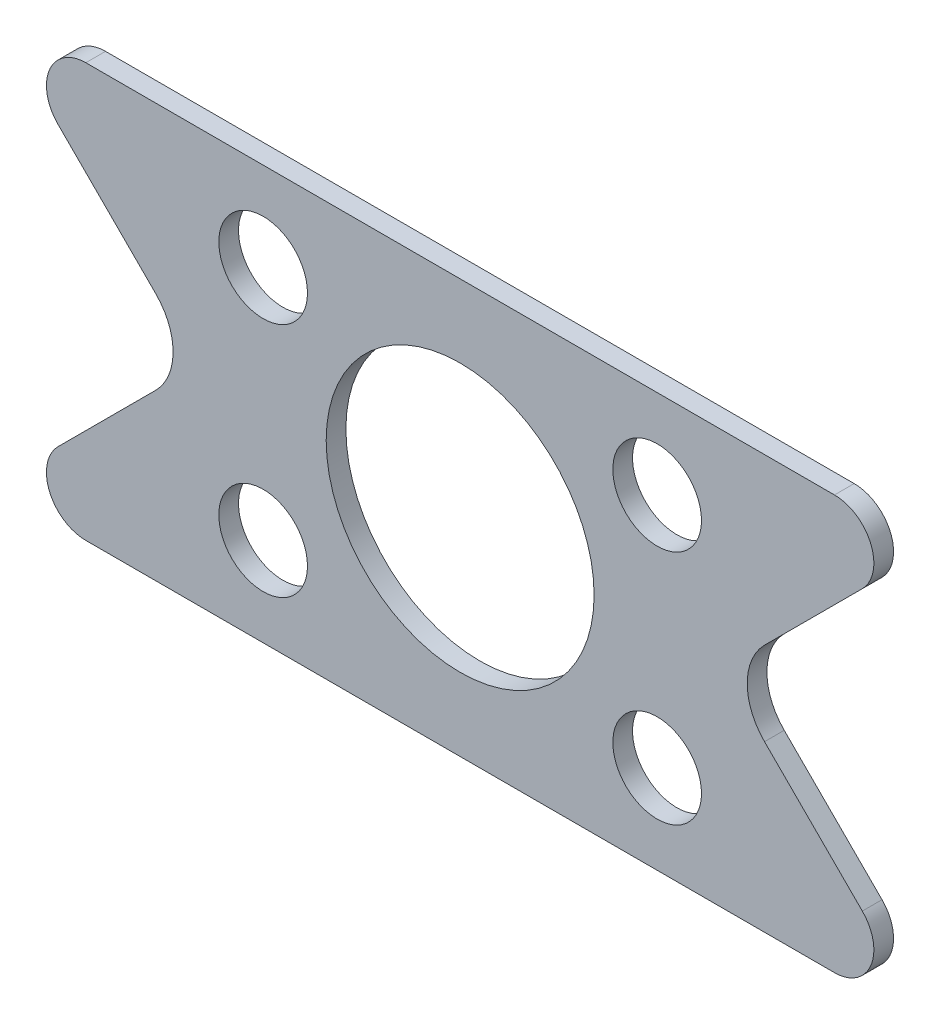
SolidWorks part; units mm, degrees
ref_plane "Plan de face" through (0, 0, 0) normal (0, 0, 1) x (1, 0, 0)
ref_plane "Plan de dessus" through (0, 0, 0) normal (0, 1, 0) x (1, 0, 0)
ref_plane "Plan de droite" through (0, 0, 0) normal (1, 0, 0) x (0, 0, -1)
sketch "Esquisse1" plane through (0, 0, 0) normal (0, 0, 1) x (1, 0, 0)
  line L1 (-210, -105) -> (210, -105)
  line L2 (-210, -105) -> (-210, 105)
  line L3 (-210, 105) -> (210, 105)
  line L4 (210, -105) -> (210, 105)
  circle A0 centre (0, 0) radius 68
  circle A1 centre (100, 60) radius 22.5
  circle A2 centre (100, -60) radius 22.5
  circle A3 centre (-100, -60) radius 22.5
  circle A4 centre (-100, 60) radius 22.5
  point P4 (0, 105)
  point P6 (-210, 0)
  dimension "D3" = 136
  dimension "D5" = 200
  dimension "D8" = 45
  dimension "D1" = 420
  dimension "D2" = 210
  dimension "D4" = 100
  dimension "D6" = 60
  dimension "D7" = 120
extrude "Extrusion1" add sketch "Esquisse1" along normal blind 10
sketch "Esquisse2" plane through (0, 0, 10) normal (0, 0, 1) x (1, 0, 0)
  line L0 (210, -105) -> (210, 105) construction
  line L1 (210, 105) -> (-210, 105) construction
  line L2 (-210, -105) -> (210, -105) construction
  line L3 (0, 0) -> (224.6287, 0) construction
  line L4 (204.1421, 70.8579) -> (154.4975, 21.2132)
  line L5 (154.4975, -21.2132) -> (204.1421, -70.8579)
  line L6 (190, 105) -> (228.981, 105)
  line L7 (190, -105) -> (228.981, -105)
  line L8 (228.981, -105) -> (228.981, 105)
  arc A0 (204.1421, 70.8579) -> (190, 105) centre (190, 85) ccw
  arc A1 (190, -105) -> (204.1421, -70.8579) centre (190, -85) ccw
  arc A2 (154.4975, 21.2132) -> (154.4975, -21.2132) centre (175.7107, 0) ccw
  point P18 (133.2843, 0)
  dimension "D1" = 40
  dimension "D2" = 40
  dimension "D5" = 30
  dimension "D3" = 45
  dimension "D4" = 45
extrude "Enlèv. mat.-Extru.1" cut sketch "Esquisse2" against normal blind 10
mirror "Symétrie1" about plane through (0, 0, 0) normal (1, 0, 0) of "Enlèv. mat.-Extru.1"
